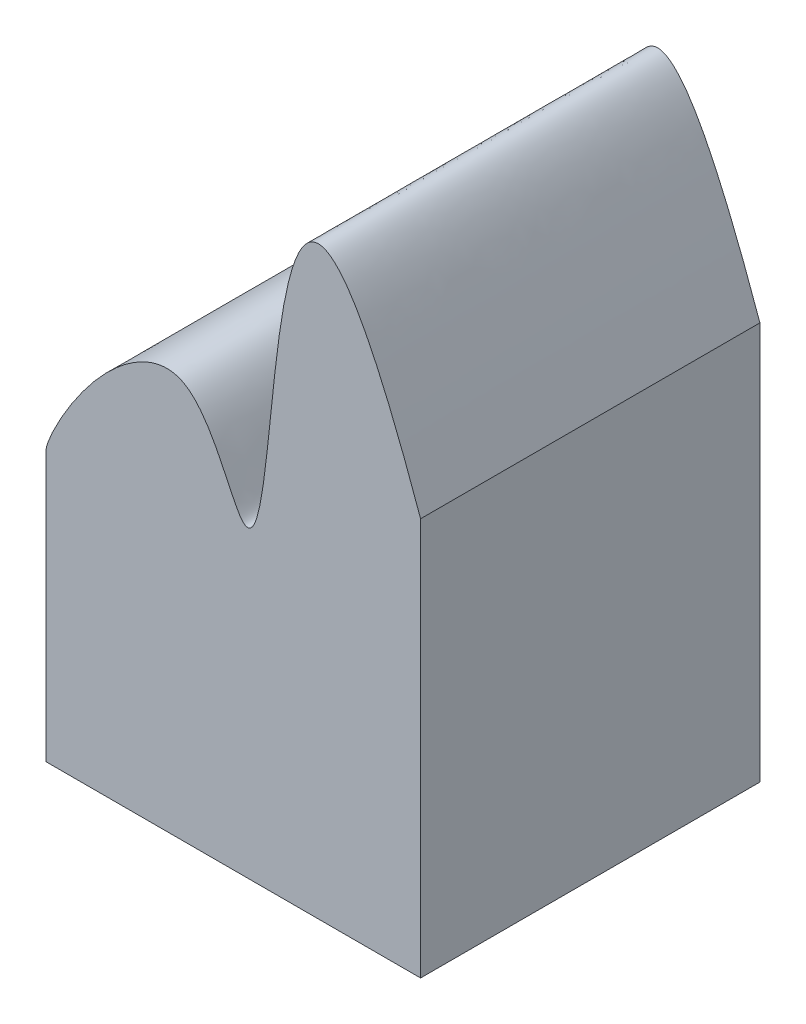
SolidWorks part; units mm, degrees
ref_plane "Front Plane" through (0, 0, 0) normal (0, 0, 1) x (1, 0, 0)
ref_plane "Top Plane" through (0, 0, 0) normal (0, 1, 0) x (1, 0, 0)
ref_plane "Right Plane" through (0, 0, 0) normal (1, 0, 0) x (0, 0, -1)
sketch "Sketch1" plane through (0, 0, 0) normal (0, 0, 1) x (1, 0, 0)
  line L0 (0, 61.989) -> (0, 0)
  line L1 (0, 0) -> (86.0856, 0)
  line L2 (86.0856, 0) -> (86.0856, 91.42)
  spline S0 degree 3 poles (86.0856, 91.42) (45.8844, 204.8377) (58.7096, 19.2775) (34.5444, 99.3891) (10.0187, 84.308) (0, 64.4052) (0, 61.989) knots 0 0 0 0 0.586791 0.733156 0.852277 1 1 1 1
extrude "Boss-Extrude1" add sketch "Sketch1" along normal mid plane 78
ref_plane "Plane1" through (-30, 0, 0) normal (-1, 0, 0) x (0, 0, 1)
sketch "Sketch2" plane through (-30, 0, 0) normal (-1, 0, 0) x (0, 0, 1)
  point P0 (-4.0937, 108.3772)
